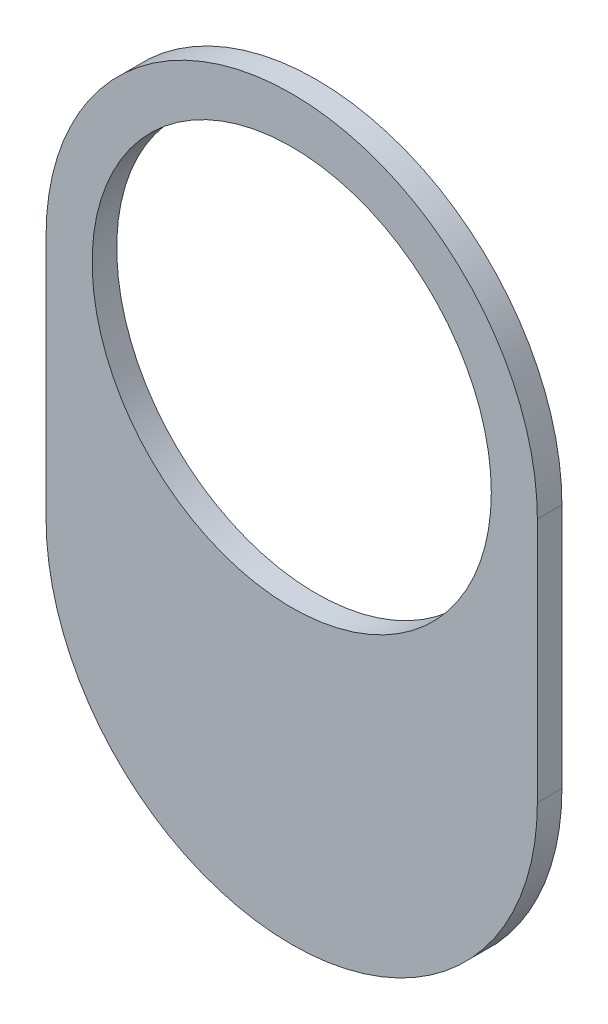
SolidWorks part; units mm, degrees
ref_plane "Front Plane" through (0, 0, 0) normal (0, 0, 1) x (1, 0, 0)
ref_plane "Top Plane" through (0, 0, 0) normal (0, 1, 0) x (1, 0, 0)
ref_plane "Right Plane" through (0, 0, 0) normal (1, 0, 0) x (0, 0, -1)
sketch "Esquisse1" plane through (0, 0, 0) normal (0, 0, 1) x (1, 0, 0)
  line L0 (-20, 0) -> (-20, -20)
  line L1 (20, 0) -> (20, -20)
  line L2 (-20, 0) -> (20, 0) construction
  circle A0 centre (0, 0) radius 16.25
  arc A1 (-20, 0) -> (20, 0) centre (0, 0) cw
  arc A2 (-20, -20) -> (20, -20) centre (0, -20) ccw
  point P5 (0, 0)
  dimension "D1" = 32.5
  dimension "D3" = 20
  dimension "D2" = 20
extrude "Boss.-Extru.1" add sketch "Esquisse1" along normal mid plane 2
